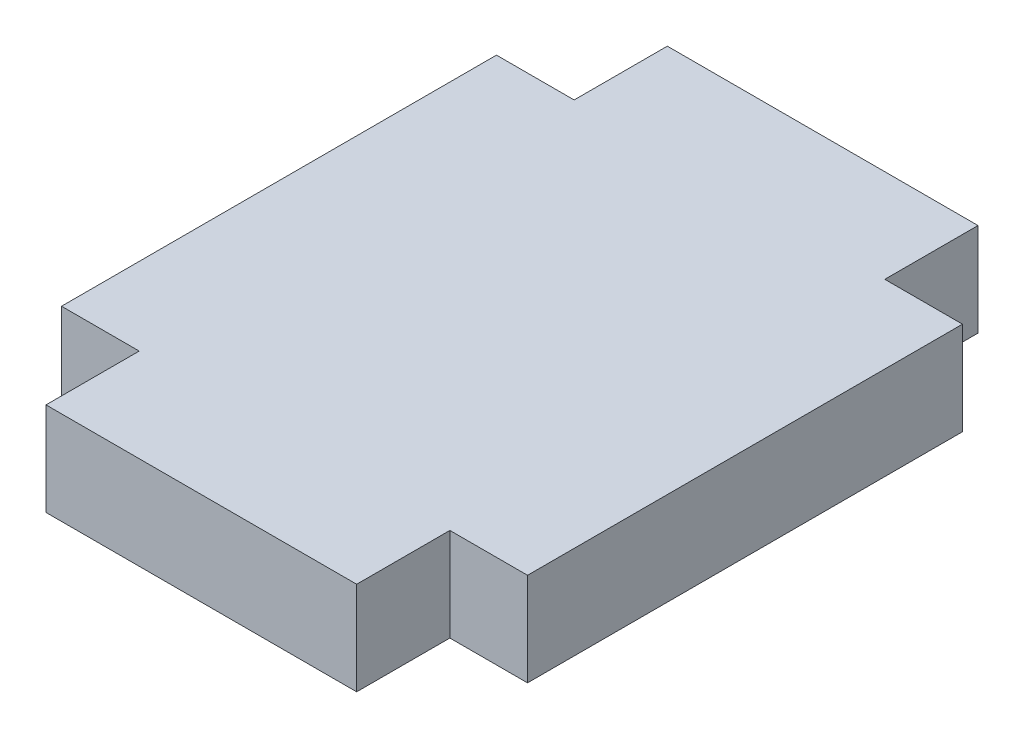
SolidWorks part; units mm, degrees
ref_plane "Ön Düzlem" through (0, 0, 0) normal (0, 0, 1) x (1, 0, 0)
ref_plane "Üst Düzlem" through (0, 0, 0) normal (0, 1, 0) x (1, 0, 0)
ref_plane "Sağ Düzlem" through (0, 0, 0) normal (1, 0, 0) x (0, 0, -1)
sketch "Çizim1" plane through (0, 0, 0) normal (0, 1, 0) x (1, 0, 0)
  line L0 (-10, 14) -> (-10, 20)
  line L1 (10, 14) -> (15, 14)
  line L2 (-15, 14) -> (-15, -14)
  line L3 (-15, -14) -> (-10, -14)
  line L4 (15, 14) -> (15, -14)
  line L5 (-15, 14) -> (15, -14) construction
  line L6 (-15, -14) -> (15, 14) construction
  line L7 (-10, 20) -> (10, 20)
  line L8 (10, 20) -> (10, 14)
  line L9 (-15, 0) -> (15, 0) construction
  line L10 (10, -20) -> (10, -14)
  line L11 (-10, -14) -> (-10, -20)
  line L12 (-10, -20) -> (10, -20)
  line L13 (10, -14) -> (15, -14)
  line L14 (-10, 14) -> (-15, 14)
  point P0 (0, 0)
  dimension "D1" = 28
  dimension "D2" = 30
  dimension "D3" = 20
  dimension "D4" = 5
  dimension "D5" = 6
extrude "Yükseklik-Ekstrüzyon1" add sketch "Çizim1" along normal blind 6
